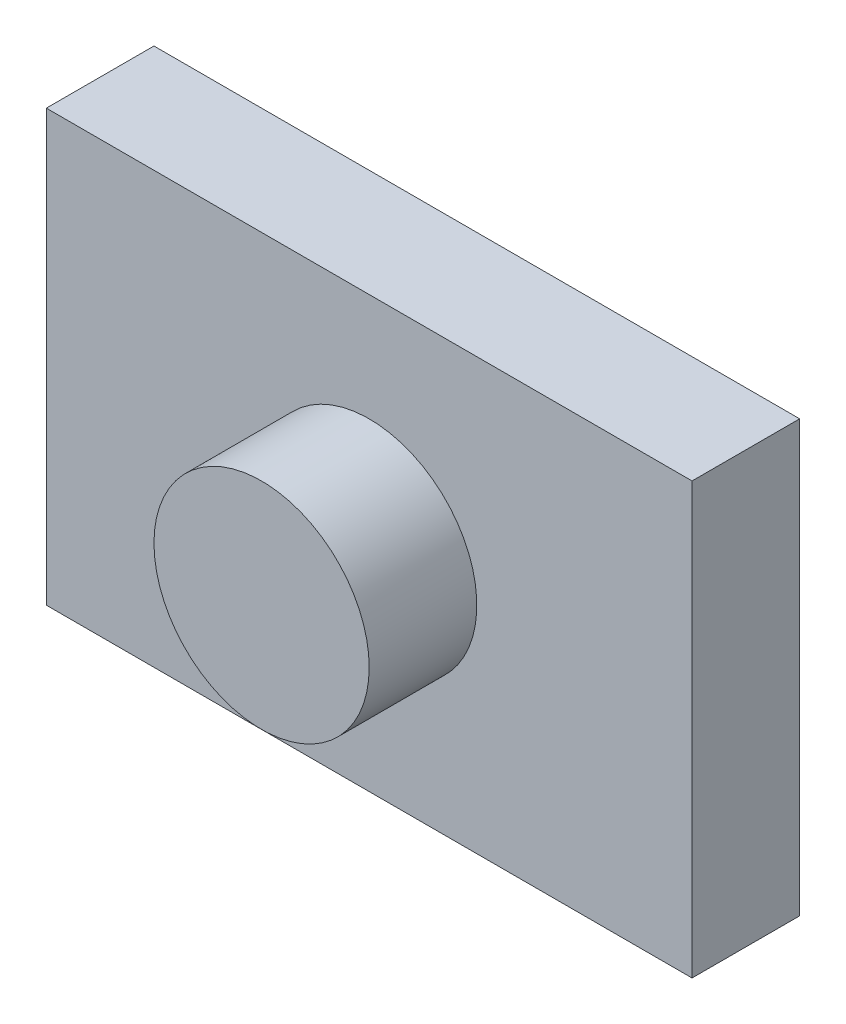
SolidWorks part; units mm, degrees
ref_plane "Front Plane" through (0, 0, 0) normal (0, 0, 1) x (1, 0, 0)
ref_plane "Top Plane" through (0, 0, 0) normal (0, 1, 0) x (1, 0, 0)
ref_plane "Right Plane" through (0, 0, 0) normal (1, 0, 0) x (0, 0, -1)
sketch "Sketch2" plane through (0, 0, 0) normal (0, 0, 1) x (1, 0, 0)
  line L1 (0, 0) -> (60, 0)
  line L2 (0, 0) -> (0, 40)
  line L3 (0, 40) -> (60, 40)
  line L4 (60, 0) -> (60, 40)
  dimension "D1" = 60
  dimension "D2" = 40
extrude "Extrude1" add sketch "Sketch2" along normal mid plane 10
sketch "Sketch3" plane through (0, 0, 5) normal (0, 0, 1) x (1, 0, 0)
  line L0 (0, 40) -> (60, 0) construction
  circle A0 centre (30, 20) radius 10
  dimension "D1" = 20
extrude "Extrude2" add sketch "Sketch3" along normal blind 10 and the other way blind 20
